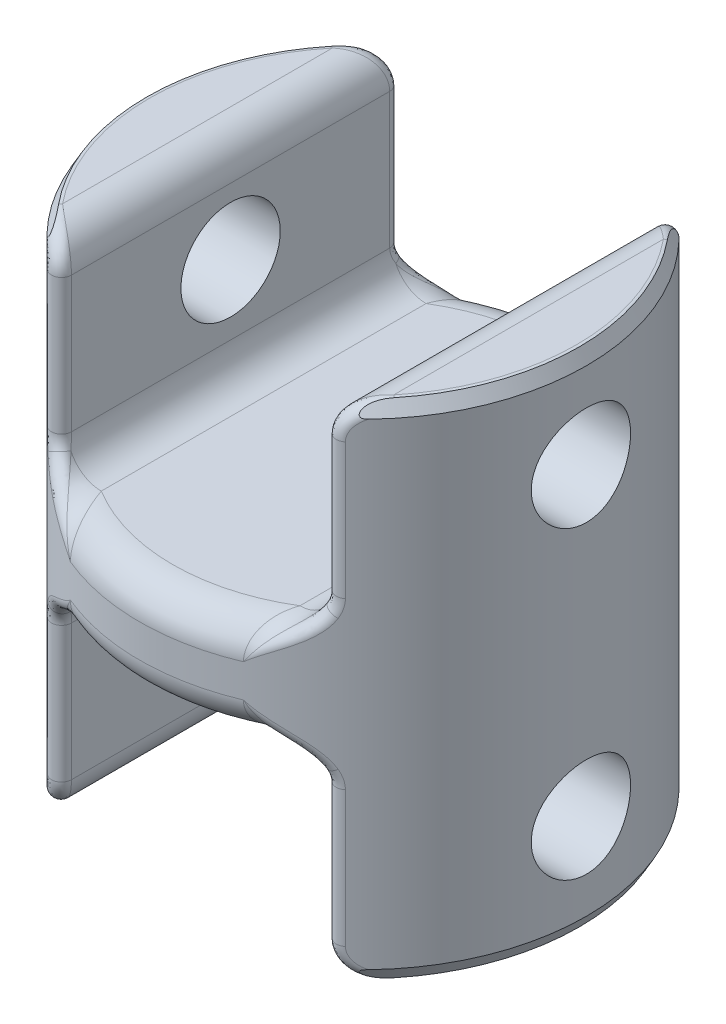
SolidWorks part; units mm, degrees
ref_plane "Plan de face" through (0, 0, 0) normal (0, 0, 1) x (1, 0, 0)
ref_plane "Plan de dessus" through (0, 0, 0) normal (0, 1, 0) x (1, 0, 0)
ref_plane "Plan de droite" through (0, 0, 0) normal (1, 0, 0) x (0, 0, -1)
sketch "Esquisse2" plane through (0, 0, 0) normal (0, 1, 0) x (1, 0, 0)
  circle A0 centre (0, 0) radius 67.5
  dimension "D1" = 135
extrude "Extrusion1" add sketch "Esquisse2" along normal blind 152
sketch "Esquisse3" plane through (0, 0, 0) normal (0, 0, 1) x (1, 0, 0)
  line L0 (0, 152) -> (0, 0) construction
  line L1 (67.5, 152) -> (-67.5, 152) construction
  line L2 (-67.5, 76) -> (67.5, 76) construction
  line L3 (-67.5, 152) -> (-67.5, 0) construction
  line L4 (67.5, 0) -> (67.5, 152) construction
  line L5 (-40, 152) -> (-40, 91)
  line L6 (-40, 91) -> (40, 91)
  line L7 (40, 152) -> (40, 91)
  line L8 (-40, 152) -> (40, 152)
  line L9 (-40, 0) -> (40, 0)
  line L10 (40, 0) -> (40, 61)
  line L11 (-40, 61) -> (40, 61)
  line L12 (-40, 0) -> (-40, 61)
  point P15 (0, 91)
  point P16 (0, 61)
  dimension "D1" = 80
  dimension "D2" = 30
extrude "Extrusion2" cut sketch "Esquisse3" against normal mid plane 152
sketch "Esquisse4" plane through (0, 0, 0) normal (1, 0, 0) x (0, 0, -1)
  line L0 (0, 152) -> (0, 0) construction
  line L1 (54.3714, 152) -> (-54.3714, 152) construction
  line L2 (-67.5, 76) -> (77.187, 76) construction
  line L3 (-67.5, 91) -> (-67.5, 61) construction
  circle A0 centre (0, 122) radius 15
  circle A1 centre (0, 30) radius 15
  dimension "D1" = 30
  dimension "D2" = 30
  dimension "D3" = 92
extrude "Extrusion3" cut sketch "Esquisse4" against normal mid plane 152
fillet "Congé7" radius 10 4 edges at (0, 61, 67.5) (0, 61, -67.5) (0, 91, -67.5) (0, 91, 67.5)
chamfer "Chanfrein1" distance 4 angle 29 4 edges at (-67.5, 0, 0) (67.5, 0, 0) (67.5, 152, 0) (-67.5, 152, 0)
fillet "Congé8" radius 10 16 edges at (40, 86.3099, -52.4647) (40, 88.4418, 50.1901) (40, 63.5582, -50.1901) (40, 65.6901, 52.4647) (-40, 65.6901, -52.4647) (-40, 63.5582, 50.1901) (40, 91, 0) (40, 61, 0) (-40, 61, 0) (-40, 0, 0) (40, 0, 0) (40, 152, 0) (-40, 152, 0) (-40, 88.4418, -50.1901) (-40, 86.3099, 52.4647) (-40, 91, 0)
fillet "Congé9" radius 3 16 edges at (-37.4823, 58.9789, -56.1367) (-40.6474, 6.4603, 53.8891) (-40.4017, 7.1941, -54.0736) (40.4017, 7.1941, 54.0736) (40.6474, 6.4603, -53.8891) (37.4823, 58.9789, -56.1367) (37.4823, 93.0211, -56.1367) (40.4017, 144.8059, -54.0736) (40.6474, 145.5397, 53.8891) (-40.4017, 144.8059, 54.0736) (-40.6474, 145.5397, -53.8891) (-37.4823, 93.0211, -56.1367) (-40, 30.7679, -54.3714) (40, 30.7679, -54.3714) (40, 121.2321, -54.3714) (-40, 121.2321, -54.3714)
